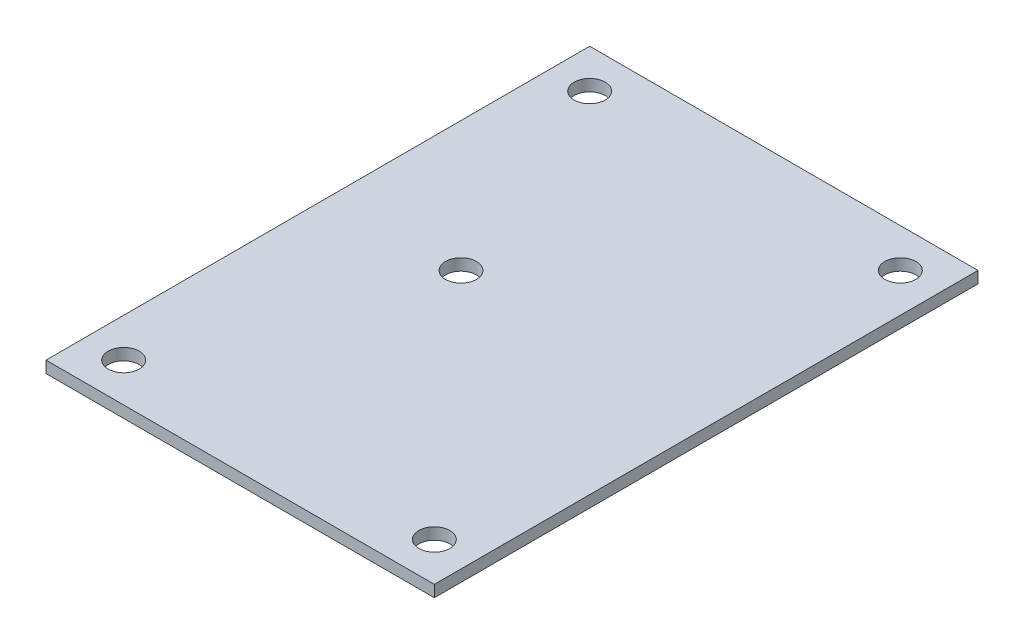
SolidWorks part; units mm, degrees
ref_plane "Front Plane" through (0, 0, 0) normal (0, 0, 1) x (1, 0, 0)
ref_plane "Top Plane" through (0, 0, 0) normal (0, 1, 0) x (1, 0, 0)
ref_plane "Right Plane" through (0, 0, 0) normal (1, 0, 0) x (0, 0, -1)
sketch "Sketch1" plane through (0, 0, 0) normal (0, 1, 0) x (1, 0, 0)
  line L0 (0, 5.6965) -> (0, -4.7489) construction
  line L1 (-25, 35) -> (25, 35)
  line L2 (-25, 35) -> (-25, -35)
  line L3 (-25, -35) -> (25, -35)
  line L4 (25, 35) -> (25, -35)
  line L5 (-25, 35) -> (25, -35) construction
  line L6 (-25, -35) -> (25, 35) construction
  line L7 (-5.6177, 0) -> (4.5809, 0) construction
  circle A0 centre (20, 30) radius 2
  circle A1 centre (-20, 30) radius 2
  circle A2 centre (-20, -30) radius 2
  circle A3 centre (20, -30) radius 2
  point P0 (0, 0)
  dimension "D3" = 4
  dimension "D1" = 50
  dimension "D2" = 70
  dimension "D4" = 30
  dimension "D5" = 20
extrude "Extrude1" add sketch "Sketch1" along normal blind 1.5
sketch "Sketch2" plane through (0, 1.5, 0) normal (0, 1, 0) x (1, 0, 0)
  line L0 (20, 30) -> (20, 0) construction
  line L1 (20, 30) -> (-12.5079, 30) construction
  line L2 (20, 30) -> (-8.2843, 1.7157) construction
  circle A0 centre (-8.2843, 1.7157) radius 2
  dimension "D3" = 4
  dimension "D1" = 40
  dimension "D2" = 45
extrude "Extrude2" cut sketch "Sketch2" against normal blind 10
